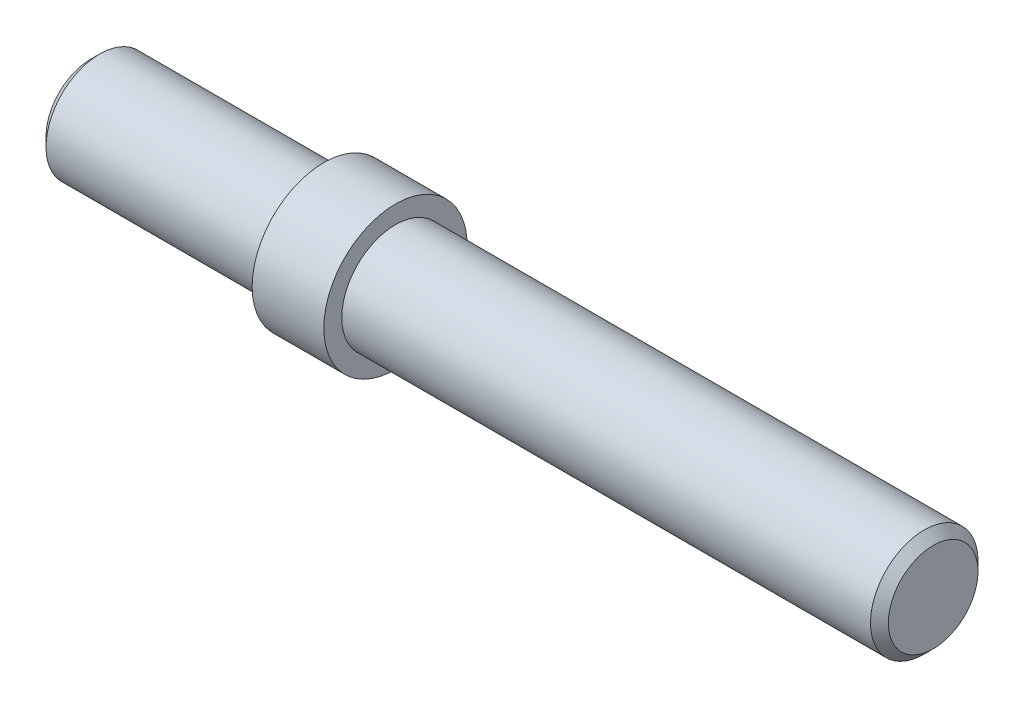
SolidWorks part; units mm, degrees
ref_plane "Face" through (0, 0, 0) normal (0, 0, 1) x (1, 0, 0)
ref_plane "Dessus" through (0, 0, 0) normal (0, 1, 0) x (1, 0, 0)
ref_plane "Droite" through (0, 0, 0) normal (1, 0, 0) x (0, 0, -1)
sketch "Esquisse1" plane through (0, 0, 0) normal (0, 0, 1) x (1, 0, 0)
  line L0 (0, 0) -> (103.4778, 0) construction
  line L1 (0, 0) -> (0, 3)
  line L2 (0, 3) -> (13, 3)
  line L3 (13, 3) -> (13, 4)
  line L4 (13, 4) -> (17, 4)
  line L5 (17, 4) -> (17, 3)
  line L6 (17, 3) -> (47, 3)
  line L7 (47, 3) -> (47, 0)
  line L8 (0, 0) -> (47, 0)
  dimension "D1" = 13
  dimension "D2" = 4
  dimension "D3" = 30
  dimension "D4" = 6
  dimension "D5" = 8
revolve "Base-Révolution" add sketch "Esquisse1" angle 360 about L0
chamfer "Chanfrein1" distance 0.5 angle 45
